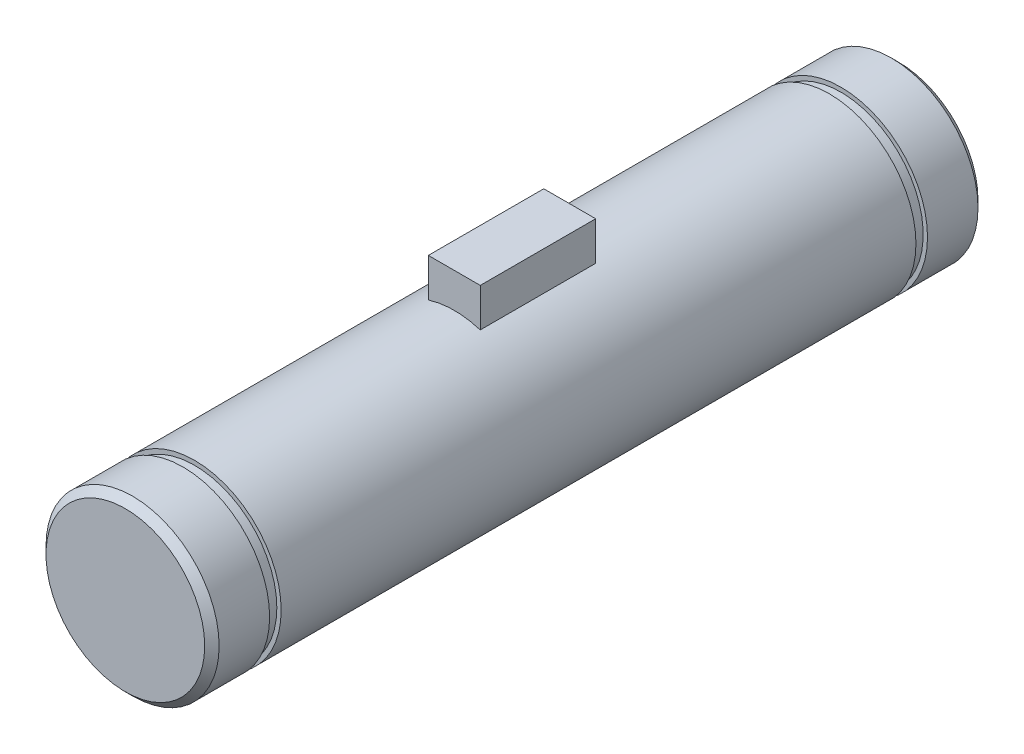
SolidWorks part; units mm, degrees
ref_plane "Спереди" through (0, 0, 0) normal (0, 0, 1) x (1, 0, 0)
ref_plane "Сверху" through (0, 0, 0) normal (0, 1, 0) x (1, 0, 0)
ref_plane "Справа" through (0, 0, 0) normal (1, 0, 0) x (0, 0, -1)
sketch "Sketch1" plane through (0, 0, 0) normal (0, 0, 1) x (1, 0, 0)
  circle A0 centre (0, 0) radius 3
  dimension "D1" = 6
extrude "Boss-Extrude1" add sketch "Sketch1" along normal blind 26.8
sketch "Sketch2" plane through (0, 0, 0) normal (0, 0, -1) x (-1, 0, 0)
  line L0 (0.9, 0) -> (0.9, 4.2)
  line L1 (0.9, 4.2) -> (-0.9, 4.2)
  line L2 (-0.9, 4.2) -> (-0.9, 0)
  line L3 (-0.9, 0) -> (0.9, 0)
  dimension "D1" = 1.8
  dimension "D2" = 4.2
  dimension "D3" = 0.9
  dimension "D4" = 0
extrude "Boss-Extrude2" add sketch "Sketch2" against normal blind 4 from offset 11.4
sketch "Sketch3" plane through (0, 0, 0) normal (0, 0, -1) x (-1, 0, 0)
  circle A0 centre (0, 0) radius 2.85
  circle A1 centre (0, 0) radius 3
  dimension "D1" = 5.7
extrude "Cut-Extrude1" cut sketch "Sketch3" against normal blind 0.4 from offset 2
sketch "Sketch4" plane through (0, 0, 26.8) normal (0, 0, 1) x (1, 0, 0)
  circle A0 centre (0, 0) radius 2.85
  circle A1 centre (0, 0) radius 3.001
  dimension "D1" = 5.7
extrude "Cut-Extrude2" cut sketch "Sketch4" against normal blind 0.4 from offset 2
chamfer "Chamfer1" distance 0.25 angle 45 2 edges at (3, 0, 0) (3, 0, 26.8)
